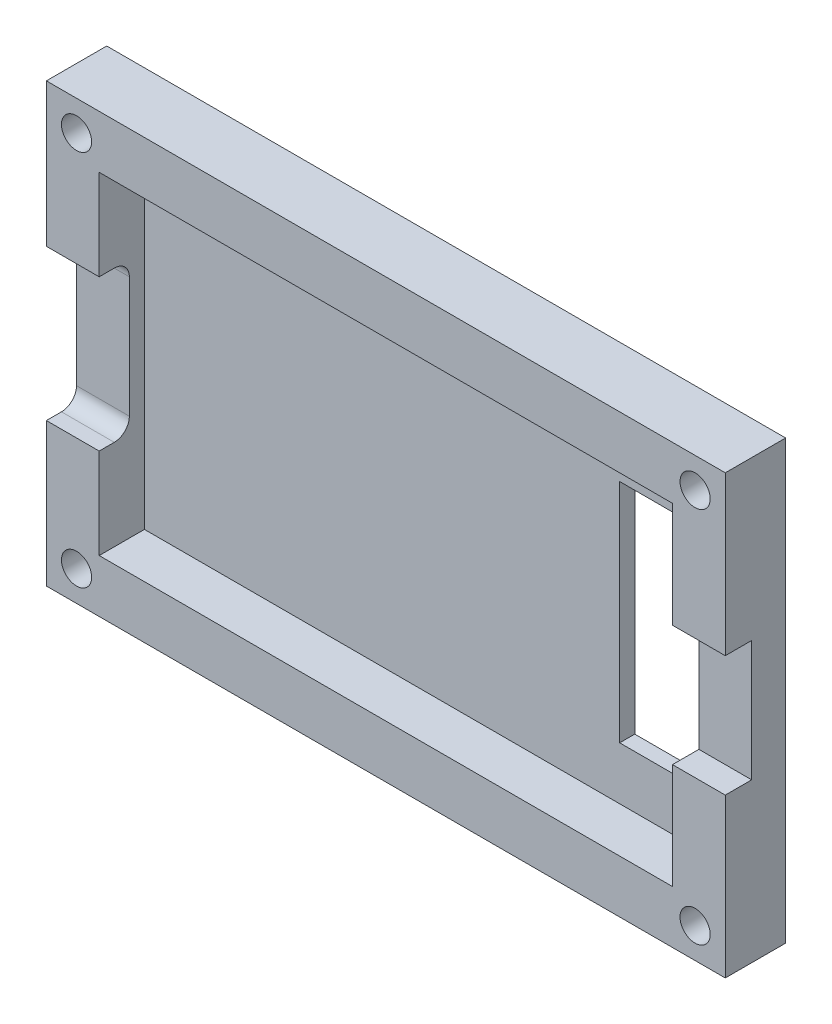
SolidWorks part; units mm, degrees
ref_plane "Alzado" through (0, 0, 0) normal (0, 0, 1) x (1, 0, 0)
ref_plane "Planta" through (0, 0, 0) normal (0, 1, 0) x (1, 0, 0)
ref_plane "Vista lateral" through (0, 0, 0) normal (1, 0, 0) x (0, 0, -1)
sketch "Sketch1" plane through (0, 0, 0) normal (0, 0, 1) x (1, 0, 0)
  line L5 (-22.5, -14.5) -> (22.5, -14.5)
  line L6 (-22.5, -14.5) -> (-22.5, 14.5)
  line L11 (-22.5, 14.5) -> (22.5, 14.5)
  line L12 (22.5, -14.5) -> (22.5, 14.5)
  line L13 (-22.5, -14.5) -> (22.5, 14.5) construction
  line L14 (-22.5, 14.5) -> (22.5, -14.5) construction
  point P0 (0, 0)
  dimension "D1" = 45
  dimension "D2" = 29
extrude "Boss-Extrude1" add sketch "Sketch1" along normal blind 4
sketch "Sketch5" plane through (0, 0, 4) normal (0, 0, 1) x (1, 0, 0)
  line L0 (22.5, 14.5) -> (-22.5, 14.5) construction
  line L1 (-19, -11) -> (19, -11)
  line L2 (-19, -11) -> (-19, 11)
  line L3 (-19, 11) -> (19, 11)
  line L4 (19, -11) -> (19, 11)
  line L5 (-19, -11) -> (19, 11) construction
  line L6 (-19, 11) -> (19, -11) construction
  line L7 (22.5, -14.5) -> (22.5, 14.5) construction
  point P0 (0, 0)
  dimension "D1" = 3.5
  dimension "D2" = 3.5
extrude "Cut-Extrude2" cut sketch "Sketch5" against normal blind 3
sketch "Sketch6" plane through (0, 0, 4) normal (0, 0, 1) x (1, 0, 0)
  line L0 (19, -11) -> (19, 11) construction
  line L1 (12.5, -7.5) -> (19, -7.5)
  line L2 (12.5, -7.5) -> (12.5, 7.5)
  line L3 (12.5, 7.5) -> (19, 7.5)
  line L4 (19, -7.5) -> (19, 7.5)
  line L5 (12.5, -7.5) -> (19, 7.5) construction
  line L6 (12.5, 7.5) -> (19, -7.5) construction
  line L7 (-22.5, 14.5) -> (-22.5, -14.5) construction
  line L8 (22.5, 14.5) -> (-22.5, 14.5) construction
  line L9 (0, 4.457) -> (0, -5.3513) construction
  line L10 (-3.9234, 0) -> (4.9619, 0) construction
  circle A0 centre (-20.5, 12.5) radius 1
  circle A1 centre (20.5, 12.5) radius 1
  circle A2 centre (20.5, -12.5) radius 1
  circle A3 centre (-20.5, -12.5) radius 1
  point P0 (15.75, 0)
  dimension "D3" = 2
  dimension "D1" = 6.5
  dimension "D2" = 15
  dimension "D4" = 2
  dimension "D5" = 2
extrude "Cut-Extrude3" cut sketch "Sketch6" against normal blind 12
sketch "Sketch7" plane through (-22.5, 0, 0) normal (-1, 0, 0) x (0, 0, 1)
  line L0 (4, 14.5) -> (4, -14.5) construction
  line L1 (3, -5) -> (5, -5)
  line L2 (2, -4) -> (2, 4)
  line L3 (3, 5) -> (5, 5)
  line L4 (6, -4) -> (6, 4)
  line L5 (2, -5) -> (6, 5) construction
  line L6 (2, 5) -> (6, -5) construction
  arc A0 (3, 5) -> (2, 4) centre (3, 4) ccw
  arc A1 (2, -4) -> (3, -5) centre (3, -4) ccw
  arc A2 (5, -5) -> (6, -4) centre (5, -4) ccw
  arc A3 (6, 4) -> (5, 5) centre (5, 4) ccw
  point P0 (4, 0)
  dimension "D3" = 1
  dimension "D1" = 4
  dimension "D2" = 10
extrude "Cut-Extrude4" cut sketch "Sketch7" against normal blind 12
sketch "Sketch8" plane through (22.5, 0, 0) normal (1, 0, 0) x (0, 0, -1)
  line L0 (-4, -14.5) -> (-4, 14.5) construction
  line L1 (-5.75, 4) -> (-2.25, 4)
  line L2 (-5.75, 4) -> (-5.75, -4)
  line L3 (-5.75, -4) -> (-2.25, -4)
  line L4 (-2.25, 4) -> (-2.25, -4)
  line L5 (-5.75, 4) -> (-2.25, -4) construction
  line L6 (-5.75, -4) -> (-2.25, 4) construction
  point P0 (-4, 0)
  dimension "D1" = 3.5
  dimension "D2" = 8
extrude "Cut-Extrude5" cut sketch "Sketch8" against normal blind 12
